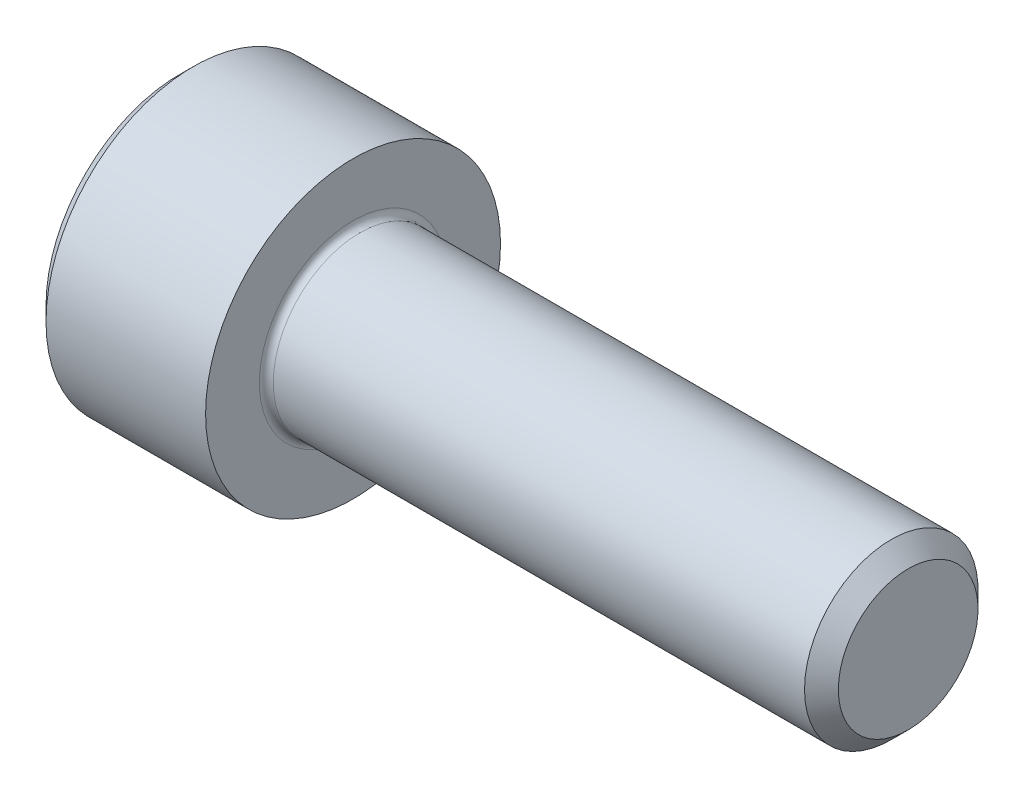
SolidWorks part; units mm, degrees
ref_plane "Plane1" through (0, 0, 0) normal (0, 0, 1) x (1, 0, 0)
ref_plane "Plane2" through (0, 0, 0) normal (0, 1, 0) x (1, 0, 0)
ref_plane "Plane3" through (0, 0, 0) normal (1, 0, 0) x (0, 0, -1)
sketch "BodySke" plane through (0, 0, 0) normal (0, 0, 1) x (1, 0, 0)
  line L0 (0, 0) -> (0, 3.85)
  line L1 (0.4, 4.25) -> (5, 4.25)
  line L2 (5, 4.25) -> (5, 2.5)
  line L3 (5, 2.5) -> (20.5125, 2.5)
  line L4 (21, 2.0125) -> (21, 0)
  line L5 (21, 0) -> (0, 0)
  line L6 (-31.75, 0) -> (127, 0) construction
  line L7 (0, 3.85) -> (0.4, 4.25)
  line L8 (21, 2.0125) -> (20.5125, 2.5)
  line L9 (0, -3.85) -> (0.4, -4.25) construction
  line L10 (21, -2.0125) -> (20.5125, -2.5) construction
  line L11 (5.7, 9.525) -> (5.7, 3.175) construction
  line L12 (5, 9.525) -> (5, 3.175) construction
  line L13 (-29, 9.525) -> (-29, 3.175) construction
  dimension "Diameter" = 5
  dimension "Head_ht" = 5
  dimension "Length" = 16
  dimension "Body_ch_ang" = 45
  dimension "Head_dia" = 8.5
  dimension "Head_ch_ang" = 45
  dimension "Minor_dia" = 4.025
  dimension "Advance" = 0.7
  dimension "Thread_nom" = 16
  dimension "Thread_length" = 50
  dimension "Head_ch_ht" = 0.4
revolve "Base-Revolve" add sketch "BodySke"
fillet "Fillet1" radius 0.2 1 edges at (5, 0, 2.5)
sketch "Sketch2" plane through (0, 0, 0) normal (0, 0, 1) x (1, 0, 0)
  line L0 (0, 1.5355) -> (2, 1.5355)
  line L1 (2, 1.5355) -> (2.8865, 0)
  line L2 (-31.75, 0) -> (127, 0) construction
  line L3 (2.8865, 0) -> (0, 0)
  line L4 (0, 0) -> (0, 1.5355)
  line L5 (0, 3.85) -> (0, -3.85) construction
  line L6 (0, 0) -> (47.625, 0) construction
  line L7 (5, -4.25) -> (5, 4.25) construction
  dimension "D1" = 1.5355
  dimension "D2" = 60
  dimension "Wall_thickness" = 3
revolve "Hex-PreBroach" cut sketch "Sketch2" angle 360 about L6
sketch "Sketch3" plane through (0, 0, 0) normal (-1, 0, 0) x (0, 0.5, 0.866)
  line L0 (0.8865, 1.5355) -> (-0.8865, 1.5355)
  line L1 (-0.8865, 1.5355) -> (-1.773, 0)
  line L2 (0.8865, 1.5355) -> (1.773, 0)
  line L3 (0.8865, -1.5355) -> (1.773, 0)
  line L4 (0.8865, -1.5355) -> (-0.8865, -1.5355)
  line L5 (-0.8865, -1.5355) -> (-1.773, 0)
  dimension "D1" = 1.5355
  dimension "D2" = 1.5355
  dimension "Hex_size" = 3.071
extrude "Hex" cut sketch "Sketch3" against normal blind 2
sketch "Sketch4" plane through (0, 0, 0) normal (-1, 0, 0) x (0, 0, 1)
  line L0 (0, 0) -> (1.7399, 0)
  line L1 (0, 0) -> (6.1484, 3.5498) construction
  line L2 (0, 0) -> (0.8699, 1.5068)
  line L3 (1.4457, 0.3947) -> (1.6607, 0.5189)
  line L4 (1.0647, 1.0546) -> (1.2797, 1.1788)
  arc A0 (1.4457, 0.3947) -> (1.0647, 1.0546) centre (0, 0) ccw
  arc A1 (1.7399, 0) -> (1.6607, 0.5189) centre (0, 0) ccw
  arc A2 (0.8699, 1.5068) -> (1.2797, 1.1788) centre (0, 0) cw
  dimension "D1" = 30
  dimension "Spline_n_dim" = 2.9972
  dimension "Spline_m_dim" = 3.4798
  dimension "D2" = 60
  dimension "D3" = 0.381
  dimension "Spline_p_dim" = 0.762
extrude "Spline" [suppressed] cut sketch "Sketch4" against normal blind 2
pattern_circular "CirPattern1" [suppressed] count 6 over 360
sketch "Sketch5" plane through (0, 0, 0) normal (0, 0, 1) x (1, 0, 0)
  line L0 (-31.75, 0) -> (127, 0) construction
  line L2 (0, 3.85) -> (0, -3.85) construction
  circle A0 centre (1.6, 0) radius 0.675
  dimension "Drilled_hole_dia" = 1.35
  dimension "Drilled_hole_loc" = 1.6
extrude "Hole" [suppressed] cut sketch "Sketch5" against normal through all and the other way through all
pattern_circular "Drilled-4" [suppressed] count 2 every 60
pattern_circular "Drilled-6" [suppressed] count 3 every 60
sketch "ThdSchSke" plane through (0, 0, 0) normal (0, 0, 1) x (1, 0, 0)
  line L0 (5.7, -2.0125) -> (5.3586, -2.5)
  line L1 (5.7, -2.0125) -> (6.0414, -2.5)
  line L2 (6.0414, -2.5) -> (6.0414, -3.125)
  line L3 (-3.175, 0) -> (5.1513, 0) construction
  line L5 (6.0414, -3.125) -> (5.3586, -3.125)
  line L6 (5.3586, -3.125) -> (5.3586, -2.5)
  line L7 (0, 3.85) -> (0, -3.85) construction
  dimension "Thread_minor" = 4.025
  dimension "Diameter" = 5
  dimension "Start" = 5.7
  dimension "SideAngle" = 55
  dimension "VeeAngle" = 70
  dimension "Overcut" = 6.25
revolve "ThreadSchematic" [suppressed] cut sketch "ThdSchSke" angle 360 about L3
pattern_linear "ThdSchPat" [suppressed]
equation "\"D2@Sketch3\" = \"Hex_size@Sketch3\" / 2"
equation "\"D1@Sketch3\" = \"Hex_size@Sketch3\" / 2"
equation "\"D1@Sketch2\" = \"Hex_size@Sketch3\" / 2"
equation "\"D3@Sketch4\" = \"Spline_p_dim@Sketch4\" / 2"
equation "\"Thread_minor@ThreadCosmetic\"  =  \"Minor_dia@BodySke\""
equation "\"D2@CirPattern1\" = 360 / \"Num_teeth@CirPattern1\""
equation "\"Wall_thickness@Sketch2\" = \"Head_ht@BodySke\" - \"Key_eng@Hex\""
equation "\"Thread_length@ThreadCosmetic\" = ((sgn( (\"Length@BodySke\" - \"Advance@BodySke\" ) - \"Thread_nom@BodySke\" )-1)*( (\"Length@BodySke\" - \"Advance@BodySke\" ) - \"Thread_nom@BodySke\" ))/-2+ \"Thread_nom@BodySke\""
equation "\"Thread_minor@ThdSchSke\" = \"Minor_dia@BodySke\""
equation "\"Diameter@ThdSchSke\" = \"Diameter@BodySke\""
equation "\"Overcut@ThdSchSke\" = \"Diameter@BodySke\" * 1.25"
equation "\"Start@ThdSchSke\" = \"Head_ht@BodySke\" + \"Length@BodySke\" - \"Thread_length@ThreadCosmetic\"  '---Non-countersunk---"
equation "\"Num_threads@ThdSchPat\" = int( \"Thread_length@ThreadCosmetic\" / \"Advance@BodySke\" + 0.999 )  + 1"
equation "\"Advance@ThdSchPat\" = \"Thread_length@ThreadCosmetic\" /  (\"Num_threads@ThdSchPat\" - 1) 'relax it"
equation "\"Num_threads@ThdSchPat\" = \"Num_threads@ThdSchPat\" - sgn( \"Num_threads@ThdSchPat\" - 1) '---chamfered tips only---"
